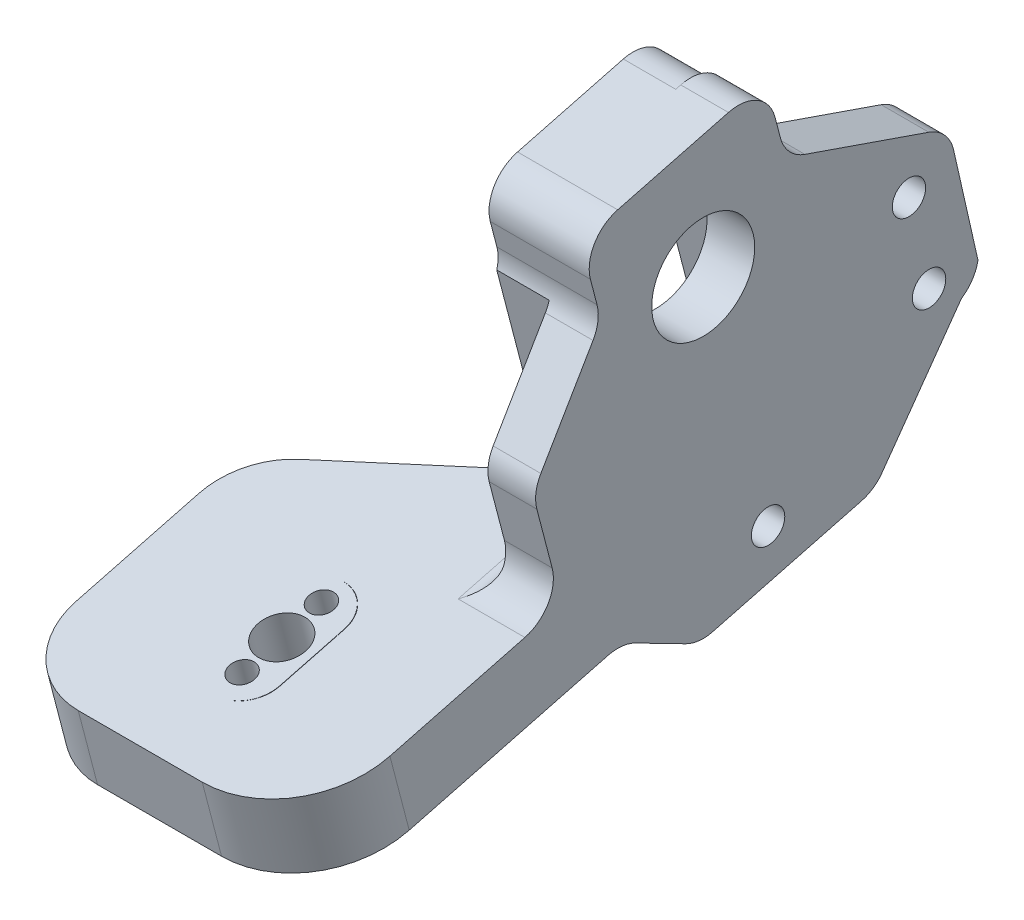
SolidWorks part; units mm, degrees
ref_plane "Front Plane" through (0, 0, 0) normal (0, 0, 1) x (1, 0, 0)
ref_plane "Top Plane" through (0, 0, 0) normal (0, 1, 0) x (1, 0, 0)
ref_plane "Right Plane" through (0, 0, 0) normal (1, 0, 0) x (0, 0, -1)
sketch "Sketch1" plane through (0, 0, 0) normal (1, 0, 0) x (0, 0, -1)
  line L13 (-32.4267, -17.25) -> (-30.4043, -24.9901)
  line L14 (20.2517, -17.9557) -> (4.6933, -22.0209)
  line L15 (1.8558, -21.7096) -> (-3.4327, -18.9955)
  line L16 (-6.2703, -18.6842) -> (-30.4043, -24.9901)
  line L17 (-12.1525, -7.8183) -> (-13.7561, -1.6812)
  line L18 (-13.3376, 1.3516) -> (-7.8651, 10.6954)
  line L19 (-7.4466, 13.7281) -> (-8.1401, 16.3822)
  line L20 (11.7814, 19.2523) -> (11.2103, 21.4382)
  line L21 (27.3399, 11.9966) -> (14.3461, 16.4825)
  line L22 (6.329, 24.297) -> (-5.2812, 21.2634)
  line L23 (22.2286, -16.7448) -> (30.7589, -4.8026)
  line L24 (32.493, -2.2023) -> (29.9046, 9.2267)
  line L25 (-32.4267, -17.25) -> (-15.0114, -12.6996)
  arc A11 (20.2517, -17.9557) -> (22.2286, -16.7448) centre (19.2405, -14.0856) ccw
  arc A12 (1.8558, -21.7096) -> (4.6933, -22.0209) centre (3.6821, -18.1509) ccw
  arc A13 (-3.4327, -18.9955) -> (-6.2703, -18.6842) centre (-5.2591, -22.5542) ccw
  arc A14 (-15.0114, -12.6996) -> (-12.1525, -7.8183) centre (-16.0226, -8.8295) ccw
  arc A15 (-13.3376, 1.3516) -> (-13.7561, -1.6812) centre (-9.886, -0.67) ccw
  arc A16 (-7.8651, 10.6954) -> (-7.4466, 13.7281) centre (-11.3167, 12.7169) ccw
  arc A17 (-5.2812, 21.2634) -> (-8.1401, 16.3822) centre (-4.27, 17.3934) ccw
  arc A18 (29.9046, 9.2267) -> (27.3399, 11.9966) centre (26.0345, 8.2155) ccw
  arc A19 (11.7814, 19.2523) -> (14.3461, 16.4825) centre (15.6515, 20.2635) ccw
  arc A20 (11.2103, 21.4382) -> (6.329, 24.297) centre (7.3402, 20.427) ccw
  arc A21 (30.7589, -4.8026) -> (32.493, -2.2023) centre (28.5625, -1.4596) ccw
  circle A22 centre (3.6839, 10.6863) radius 5.4
  circle A23 centre (25.2543, 7.1236) radius 1.75
  circle A24 centre (27.3633, -2.2157) radius 1.75
  circle A25 centre (10.4843, -15.34) radius 1.75
  dimension "D1" = 11.7185
  dimension "D11" = 4
  dimension "D12" = 4
  dimension "D13" = 4
  dimension "D14" = 4
  dimension "D15" = 4
  dimension "D16" = 4
  dimension "D17" = 4
  dimension "D18" = 4
  dimension "D19" = 4
  dimension "D21" = 4
  dimension "D22" = 4
  dimension "D31" = 10.8
  dimension "D35" = 3.5
  dimension "D36" = 3.5
  dimension "D39" = 3.5
  dimension "D2" = 13.7463
  dimension "D3" = 14.6759
  dimension "D4" = 16.0807
  dimension "D5" = 12
  dimension "D6" = 10.8284
  dimension "D7" = 6.3431
  dimension "D8" = 18
  dimension "D9" = 24.9443
  dimension "D10" = 5.9443
  dimension "D20" = 2.654
  dimension "D23" = 8
  dimension "D24" = 2.2593
  dimension "D25" = 3.0336
  dimension "D26" = 12
  dimension "D27" = 15.5584
  dimension "D28" = 10
  dimension "D29" = 12.5
  dimension "D30" = 10
  dimension "D32" = 5
  dimension "D33" = 30.9691
  dimension "D34" = 21.4
  dimension "D37" = 5
  dimension "D38" = 20
extrude "Boss-Extrude1" add sketch "Sketch1" against normal blind 5
sketch "Sketch4" plane through (0, 0, 0) normal (1, 0, 0) x (0, 0, -1)
  line L0 (17.5121, -4.8217) -> (10.6865, 21.3013)
  line L1 (2.9993, -12.748) -> (14.6533, -9.7029)
  line L2 (-3.0011, -5.4271) -> (0.0325, -17.0373)
  line L3 (-8.6639, 16.2453) -> (-3.0011, -5.4271)
  line L4 (5.8052, 24.1602) -> (-5.805, 21.1266)
  line L5 (7.8058, 18.4815) -> (-4.772, 15.1951)
  line L6 (-4.772, 15.1951) -> (1.0425, -7.0579)
  line L7 (1.0425, -7.0579) -> (13.6202, -3.7714)
  line L8 (13.6202, -3.7714) -> (7.8058, 18.4815)
  line L10 (6.329, 24.297) -> (-5.2812, 21.2634) construction
  arc A0 (-2.0645, 9.1843) -> (8.3847, 11.9145) centre (3.1601, 10.5494) ccw
  arc A1 (14.6533, -9.7029) -> (17.5121, -4.8217) centre (13.6421, -5.8329) ccw
  arc A2 (2.9993, -12.748) -> (0.0325, -17.0373) centre (4.0105, -16.6181) ccw
  arc A3 (-5.805, 21.1266) -> (-8.6639, 16.2453) centre (-4.7938, 17.2565) ccw
  arc A4 (10.6865, 21.3013) -> (5.8052, 24.1602) centre (6.8164, 20.2901) ccw
  arc A5 (8.3847, 11.9145) -> (1.795, 15.774) centre (3.1601, 10.5494) ccw
  arc A6 (1.795, 15.774) -> (-2.0645, 9.1843) centre (3.1601, 10.5494) ccw
  point P21 (0, 0)
  point P22 (14.0993, 8.2398)
  point P24 (-75.0434, 25.3026)
  dimension "D10" = 4
  dimension "D11" = 4
  dimension "D12" = 4
  dimension "D13" = 4
  dimension "D20" = 5.4
  dimension "D1" = 13
  dimension "D2" = 23
  dimension "D3" = 13
  dimension "D4" = 23
  dimension "D5" = 22.4
  dimension "D6" = 12
  dimension "D7" = 12.0453
  dimension "D8" = 27
  dimension "D9" = 12
  dimension "D14" = 90
  dimension "D15" = 6.5
  dimension "D16" = 3.5
  dimension "D17" = 3.5
  dimension "D18" = 6
  dimension "D19" = 6
extrude "Boss-Extrude2" add sketch "Sketch4" against normal blind 10.5 contours L0 A4 L3 L2 A2 L1 A1 L8 L7 L6 L5 M37 M38 M39 M40
sketch "Sketch5" plane through (0, -15.9564, -4.1692) normal (0, -0.9675, -0.2528) x (1, 0, 0)
  line L1 (-10.5, 4.2756) -> (-27.0958, 14.1671)
  line L2 (-31, 21.0391) -> (-31, 34.3591)
  line L3 (-23, 42.3591) -> (-15, 42.3591)
  line L7 (-5, 35.7343) -> (-5, 10.79) construction
  line L8 (-10.5, 4.2756) -> (-5, 4.2756)
  line L9 (-5, 4.2756) -> (-5, 35.7343)
  line L10 (-5, 35.7343) -> (0, 35.7343) construction
  line L11 (-15.5, 24.8591) -> (-15.5, 31.8591) construction
  line L12 (-19, 24.8591) -> (-19, 31.8591)
  line L13 (-12, 24.8591) -> (-12, 31.8591)
  line L18 (-15, 42.3591) -> (0, 42.3591)
  line L19 (0, 42.3591) -> (0, 35.7343)
  line L20 (0, 35.7343) -> (-5, 35.7343)
  arc A0 (-27.0958, 14.1671) -> (-31, 21.0391) centre (-23, 21.0391) cw
  arc A1 (-31, 34.3591) -> (-23, 42.3591) centre (-23, 34.3591) cw
  arc A3 (-19, 24.8591) -> (-12, 24.8591) centre (-15.5, 24.8591) ccw
  arc A4 (-12, 31.8591) -> (-19, 31.8591) centre (-15.5, 31.8591) ccw
  point P20 (-15.5, 28.3591)
  dimension "D2" = 8
  dimension "D5" = 10.5
  dimension "D6" = 8
  dimension "D7" = 7
  dimension "D1" = 13.32
  dimension "D3" = 19.32
  dimension "D4" = 8
  dimension "D8" = 7
  dimension "D9" = 15.5
extrude "Boss-Extrude3" add sketch "Sketch5" against normal blind 8 contours L13 A4 L12 A3 | L20 L9 L8 L1 A0 L2 A1 L3 L18 L19
sketch "Sketch6" plane through (0, -15.9564, -4.1692) normal (0, -0.9675, -0.2528) x (1, 0, 0)
  line L0 (-15.5315, 31.866) -> (-15.5315, 24.866) construction
  line L1 (-12.0315, 31.866) -> (-12.0315, 24.866)
  line L2 (-19.0315, 31.866) -> (-19.0315, 24.866)
  arc A0 (-12.0315, 31.866) -> (-19.0315, 31.866) centre (-15.5315, 31.866) ccw
  arc A1 (-19.0315, 24.866) -> (-12.0315, 24.866) centre (-15.5315, 24.866) ccw
  point P2 (-15.5315, 28.366)
  dimension "D1" = 7
  dimension "D2" = 7
extrude "Boss-Extrude4" add sketch "Sketch6" against normal blind 5 from offset 3
sketch "Sketch7" plane through (0, -13.0539, -3.4108) normal (0, -0.9675, -0.2528) x (1, 0, 0)
  line L0 (-1015.3903, 28.1726) -> (48984.6097, 28.1726) construction
  line L1 (-15.3903, -972.8288) -> (-15.3903, 49027.1712) construction
  circle A0 centre (-15.3903, 28.1726) radius 2.5
  circle A1 centre (-15.3903, 32.4726) radius 1.3
  circle A2 centre (-15.3903, 23.8726) radius 1.3
  dimension "D1" = 2.6
  dimension "D2" = 5
  dimension "D3" = 2.6
  dimension "D4" = 4.3
  dimension "D5" = 4.3
extrude "Cut-Extrude2" cut sketch "Sketch7" against normal blind 5
fillet "Fillet1" radius 10 1 edges at (0, -22.7948, 37.8251)
fillet "Fillet5" radius 2 2 edges at (-5, -10.9984, 8.5006) (-7.75, -9.2972, 1.9899)
